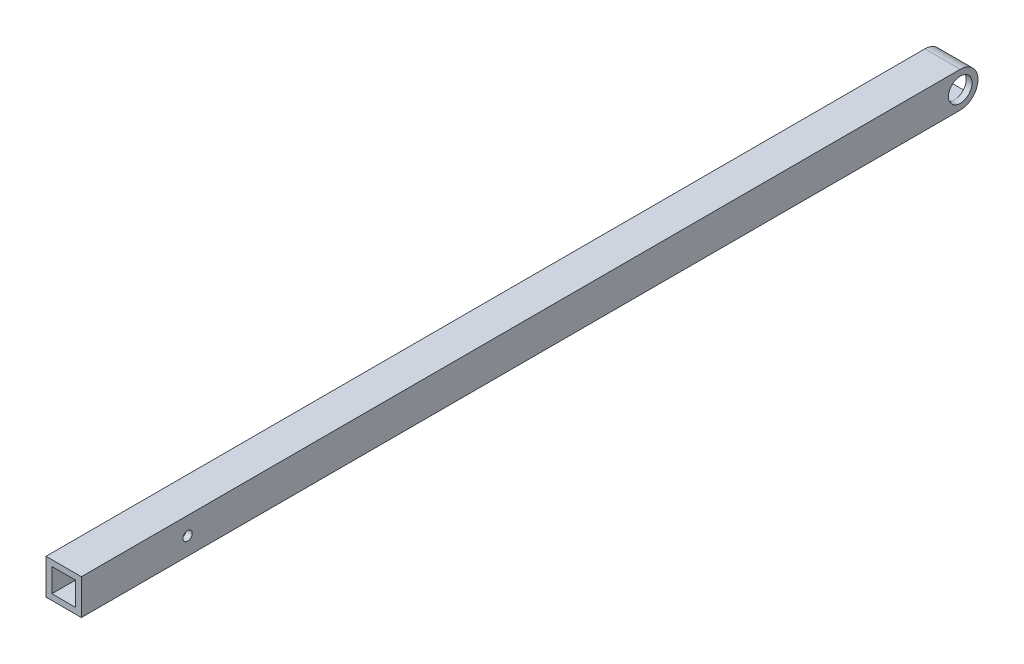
SolidWorks part; units mm, degrees
ref_plane "Front" through (0, 0, 0) normal (0, 0, 1) x (1, 0, 0)
ref_plane "Top" through (0, 0, 0) normal (0, 1, 0) x (1, 0, 0)
ref_plane "Right" through (0, 0, 0) normal (1, 0, 0) x (0, 0, -1)
sketch "Sketch1" plane through (0, 0, 0) normal (0, 0, 1) x (1, 0, 0)
  line L0 (-6.35, 6.35) -> (6.35, 6.35)
  line L1 (-9.525, -9.525) -> (9.525, -9.525)
  line L2 (-9.525, -9.525) -> (-9.525, 9.525)
  line L3 (-9.525, 9.525) -> (9.525, 9.525)
  line L4 (9.525, -9.525) -> (9.525, 9.525)
  line L5 (-9.525, -9.525) -> (9.525, 9.525) construction
  line L6 (-9.525, 9.525) -> (9.525, -9.525) construction
  line L7 (6.35, -6.35) -> (6.35, 6.35)
  line L8 (-6.35, -6.35) -> (6.35, -6.35)
  line L9 (-6.35, -6.35) -> (-6.35, 6.35)
  point P0 (0, 0)
  dimension "D1" = 19.05
  dimension "D2" = 3.175
extrude "Boss-Extrude1" add sketch "Sketch1" along normal blind 482.6
sketch "Sketch2" plane through (9.525, 0, 0) normal (1, 0, 0) x (0, 0, -1)
  line L0 (0, 0) -> (-482.6, 0) construction
  line L1 (-482.6, -9.525) -> (-482.6, 9.525) construction
  line L2 (-9.525, 9.525) -> (-9.525, -9.525) construction
  line L3 (-482.6, 9.525) -> (0, 9.525) construction
  line L4 (-482.6, -9.525) -> (0, -9.525) construction
  line L5 (-9.525, -9.525) -> (0, -9.525)
  line L6 (0, -9.525) -> (0, 9.525)
  line L7 (0, 9.525) -> (-9.525, 9.525)
  circle A0 centre (-9.525, 0) radius 6.35
  arc A1 (-9.525, 9.525) -> (-9.525, -9.525) centre (-9.525, 0) cw
  dimension "D1" = 12.7
  dimension "D2" = 9.525
extrude "Cut-Extrude1" cut sketch "Sketch2" against normal through all contours A0 | A1 M1 M4 | A1 L6 M2
sketch "Sketch3" plane through (-9.525, 0, 0) normal (-1, 0, 0) x (0, 0, 1)
  line L0 (482.6, -9.525) -> (482.6, 9.525) construction
  line L1 (482.6, -9.525) -> (9.525, -9.525) construction
  circle A2 centre (425.4246, 0) radius 2.4892
  dimension "D1" = 4.9784
  dimension "D2" = 57.1754
  dimension "D3" = 9.525
extrude "Cut-Extrude2" cut sketch "Sketch3" against normal through all
